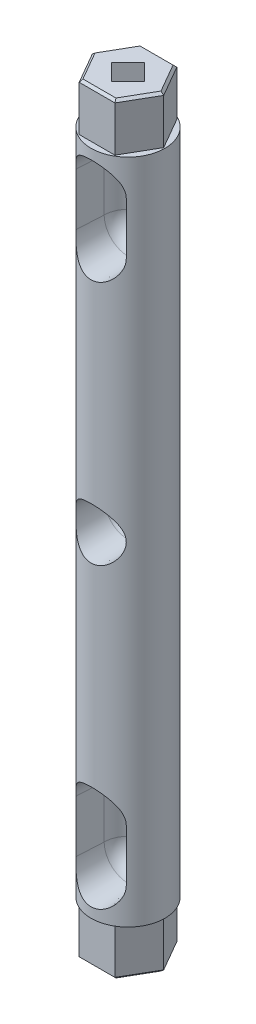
SolidWorks part; units mm, degrees
ref_plane "Front Plane" through (0, 0, 0) normal (0, 0, 1) x (1, 0, 0)
ref_plane "Top Plane" through (0, 0, 0) normal (0, 1, 0) x (1, 0, 0)
ref_plane "Right Plane" through (0, 0, 0) normal (1, 0, 0) x (0, 0, -1)
sketch "Sketch1" plane through (0, 0, 0) normal (0, 1, 0) x (1, 0, 0)
  circle A0 centre (0, 0) radius 7.75
extrude "Boss-Extrude1" add sketch "Sketch1" along normal blind 140
sketch "Sketch2" plane through (0, 0, 0) normal (0, 0, 1) x (1, 0, 0)
  line L0 (0, 140) -> (0, 132.5) construction
  line L1 (7.75, 140) -> (-7.75, 140) construction
  line L2 (0, 140) -> (0, 0) construction
  line L3 (7.75, 70) -> (-7.75, 70) construction
  line L4 (0, 132.5) -> (0, 122.5) construction
  line L5 (-5, 132.5) -> (-5, 122.5)
  line L6 (5, 132.5) -> (5, 122.5)
  line L7 (7.75, 0) -> (7.75, 140) construction
  line L8 (0, 17.5) -> (0, 18.5) construction
  line L9 (0, 7.5) -> (0, 17.5) construction
  line L10 (0, 122.5) -> (0, 121.5) construction
  line L11 (5, 122.5) -> (5, 121.5)
  line L12 (-5, 122.5) -> (-5, 121.5)
  line L13 (-7.75, 140) -> (-7.75, 0) construction
  line L14 (-5, 17.5) -> (-5, 18.5)
  line L15 (5, 17.5) -> (5, 18.5)
  line L16 (5, 7.5) -> (5, 17.5)
  line L17 (-5, 7.5) -> (-5, 17.5)
  arc A0 (5, 132.5) -> (-5, 132.5) centre (0, 132.5) ccw
  circle A1 centre (0, 70) radius 5
  arc A2 (-5, 18.5) -> (5, 18.5) centre (0, 18.5) cw
  arc A3 (5, 7.5) -> (-5, 7.5) centre (0, 7.5) cw
  arc A5 (-5, 121.5) -> (5, 121.5) centre (0, 121.5) ccw
  dimension "D1" = 10
  dimension "D2" = 1
  dimension "D4" = 7.5
extrude "Cut-Extrude1" cut sketch "Sketch2" along normal through all draft 3
ref_axis "Axis1" through (0, 140, 0) along (0, -1, 0)
sketch "Sketch3" plane through (0, 0, 0) normal (0, 0, 1) x (1, 0, 0)
  line L0 (-5, 18.5) -> (5, 18.5) construction
  line L1 (0, 75) -> (0, 65)
  line L2 (0, 137.5) -> (0, 130)
  line L3 (0, 132.5) -> (0, 121.5) construction
  line L4 (5, 132.5) -> (5, 121.5)
  line L5 (0, 130) -> (0, 116.5)
  line L6 (0, 7.5) -> (0, 23.5)
  line L7 (5, 18.5) -> (5, 7.5)
  line L8 (-5, 120.66) -> (5, 120.66) construction
  line L9 (0, 7.5) -> (0, 2.5)
  line L10 (-5, 121.5) -> (5, 121.5) construction
  line L12 (5.2965, 7.5) -> (5, 7.5) construction
  line L13 (5, 121.5) -> (5, 132.5) construction
  line L14 (-5, 7.5) -> (5, 7.5) construction
  arc A0 (5, 132.5) -> (0, 137.5) centre (0, 132.5) ccw
  arc A1 (0, 65) -> (0, 75) centre (0, 70) ccw
  arc A2 (5, 18.5) -> (0, 23.5) centre (0, 18.5) ccw
  arc A3 (0, 116.5) -> (5, 121.5) centre (0, 121.5) ccw
  arc A4 (5, 7.5) -> (0, 2.5) centre (0, 7.5) cw
revolve "Cut-Revolve1" cut sketch "Sketch3" angle 360 about axis through (0, 140, 0) along (0, -1, 0)
sketch "Sketch4" plane through (0, 140, 0) normal (0, 1, 0) x (1, 0, 0)
  line L1 (7.5, 0) -> (3.75, 6.4952)
  line L2 (3.75, 6.4952) -> (-3.75, 6.4952)
  line L3 (-3.75, 6.4952) -> (-7.5, 0)
  line L4 (-7.5, 0) -> (-3.75, -6.4952)
  line L5 (-3.75, -6.4952) -> (3.75, -6.4952)
  line L6 (3.75, -6.4952) -> (7.5, 0)
  circle A0 centre (0, 0) radius 6.4952 construction
extrude "Boss-Extrude2" add sketch "Sketch4" along normal blind 10
sketch "Sketch5" plane through (0, 0, 0) normal (0, -1, 0) x (-1, 0, 0)
  line L1 (-7.5, 0) -> (-3.75, -6.4952)
  line L2 (-3.75, -6.4952) -> (3.75, -6.4952)
  line L3 (3.75, -6.4952) -> (7.5, 0)
  line L4 (7.5, 0) -> (3.75, 6.4952)
  line L5 (3.75, 6.4952) -> (-3.75, 6.4952)
  line L6 (-3.75, 6.4952) -> (-7.5, 0)
  circle A0 centre (0, 0) radius 6.4952 construction
extrude "Boss-Extrude3" add sketch "Sketch5" along normal blind 10
hole_wizard "#10 (0.1935) Diameter Hole1" positions "Sketch7" profile "Sketch6" hole size "#10" standard "ANSI Inch"
sketch "Sketch7" plane through (0, 150, 0) normal (0, 1, 0) x (1, 0, 0)
  point P0 (0, 0)
sketch "Sketch6" plane through (0, 150, 0) normal (1, 0, 0) x (0, 0, 1)
  line L0 (0, 0) -> (0, 6.4766)
  line L1 (0, 6.4766) -> (2.4574, 5)
  line L2 (2.4574, 5) -> (2.4574, 0)
  line L5 (2.4574, 0) -> (0, 0)
  line L10 (0, 6.4766) -> (-2.4574, 5) construction
  line L11 (0, -6.35) -> (0, 107.95) construction
  dimension "Hole Dia." = 4.9149
  dimension "Hole Depth" = 5
  dimension "Drill Angle" = 118
hole_wizard "#10 (0.1935) Diameter Hole2" positions "Sketch10" profile "Sketch9" hole size "#10" standard "ANSI Inch"
sketch "Sketch10" plane through (0, -10, 0) normal (0, -1, 0) x (-1, 0, 0)
  point P0 (0, 0)
sketch "Sketch9" plane through (0, -10, 0) normal (1, 0, 0) x (0, 0, -1)
  line L0 (0, 0) -> (0, 6.4766)
  line L1 (0, 6.4766) -> (2.4574, 5)
  line L2 (2.4574, 5) -> (2.4574, 0)
  line L5 (2.4574, 0) -> (0, 0)
  line L10 (0, 6.4766) -> (-2.4574, 5) construction
  line L11 (0, -6.35) -> (0, 107.95) construction
  dimension "Hole Dia." = 4.9149
  dimension "Hole Depth" = 5
  dimension "Drill Angle" = 118
sketch "Sketch11" plane through (0, 150, 0) normal (0, 1, 0) x (1, 0, 0)
  line L0 (0, 4.4419) -> (0, -4.4225) construction
  line L1 (-4.1212, 0) -> (4.1989, 0) construction
  line L2 (0, 3.4876) -> (3.4876, 0) construction
  line L3 (0, 3.4876) -> (3.4876, 0)
  line L4 (3.4876, 0) -> (0, -3.4876)
  line L5 (0, -3.4876) -> (-3.4876, 0)
  line L6 (-3.4876, 0) -> (0, 3.4876)
  circle A0 centre (0, 0) radius 2.4574 construction
extrude "Cut-Extrude2" cut sketch "Sketch11" against normal blind 10
sketch "Sketch12" plane through (0, -10, 0) normal (0, -1, 0) x (-1, 0, 0)
  line L0 (0, -3.4876) -> (-3.4876, 0)
  line L1 (-3.4876, 0) -> (0, 3.4876)
  line L2 (0, 3.4876) -> (3.4876, 0)
  line L3 (3.4876, 0) -> (0, -3.4876)
extrude "Cut-Extrude3" cut sketch "Sketch12" against normal blind 10
chamfer "Chamfer1" distance 0.5 angle 45 6 edges at (0, 150, 6.4952) (-5.625, 150, 3.2476) (-5.625, 150, -3.2476) (0, 150, -6.4952) (5.625, 150, -3.2476) (5.625, 150, 3.2476)
chamfer "Chamfer2" distance 0.5 angle 45 6 edges at (-5.625, -10, 3.2476) (-5.625, -10, -3.2476) (0, -10, -6.4952) (5.625, -10, -3.2476) (5.625, -10, 3.2476) (0, -10, 6.4952)
